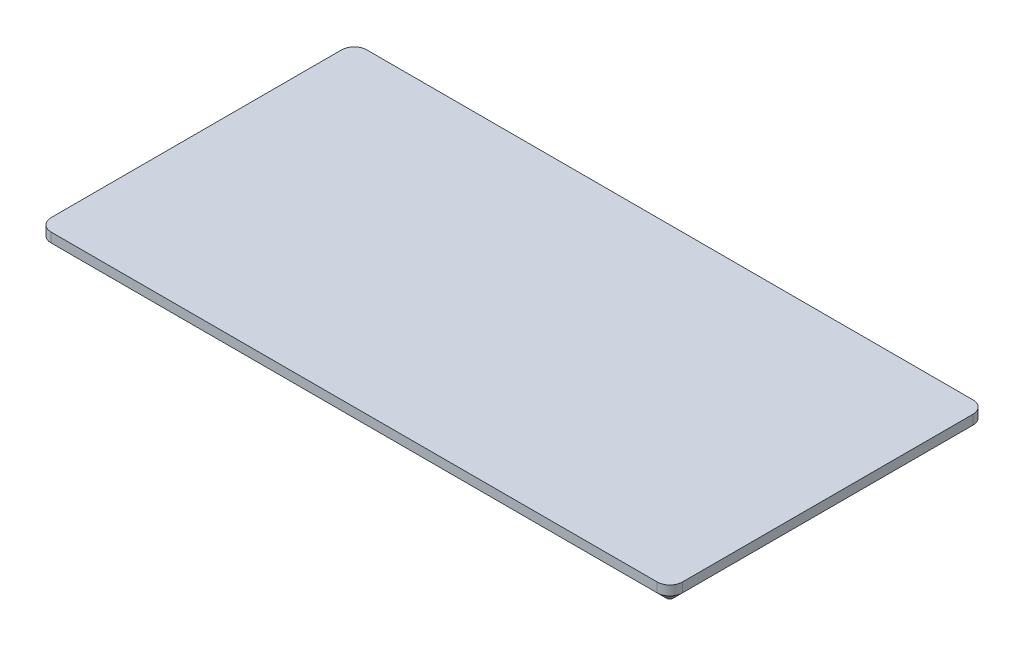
SolidWorks part; units mm, degrees
ref_plane "Front Plane" through (0, 0, 0) normal (0, 0, 1) x (1, 0, 0)
ref_plane "Top Plane" through (0, 0, 0) normal (0, 1, 0) x (1, 0, 0)
ref_plane "Right Plane" through (0, 0, 0) normal (1, 0, 0) x (0, 0, -1)
sketch "Sketch1" plane through (0, 0, 0) normal (0, 1, 0) x (1, 0, 0)
  line L1 (-500, 250) -> (500, 250)
  line L2 (-500, 250) -> (-500, -250)
  line L3 (-500, -250) -> (500, -250)
  line L4 (500, 250) -> (500, -250)
  line L5 (-500, 250) -> (500, -250) construction
  line L6 (-500, -250) -> (500, 250) construction
  point P0 (0, 0)
  dimension "D1" = 1000
  dimension "D2" = 500
extrude "Boss-Extrude1" add sketch "Sketch1" along normal blind 30
fillet "Fillet2" radius 20 4 edges at (500, 15, 250) (-500, 15, 250) (500, 15, -250) (-500, 15, -250)
chamfer "Chamfer2" distance 15 angle 45 8 edges at (500, 0, 0) (494.1421, 0, -244.1421) (494.1421, 0, 244.1421) (0, 0, -250) (0, 0, 250) (-494.1421, 0, -244.1421) (-494.1421, 0, 244.1421) (-500, 0, 0)
